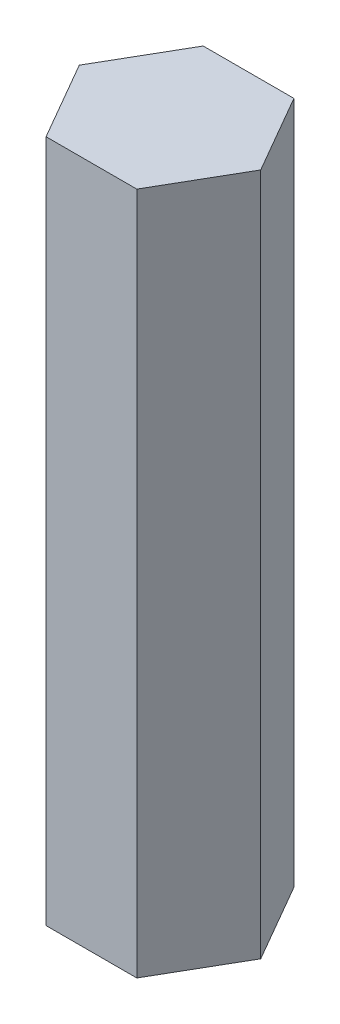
SolidWorks part; units mm, degrees
ref_plane "前视基准面" through (0, 0, 0) normal (0, 0, 1) x (1, 0, 0)
ref_plane "上视基准面" through (0, 0, 0) normal (0, 1, 0) x (1, 0, 0)
ref_plane "右视基准面" through (0, 0, 0) normal (1, 0, 0) x (0, 0, -1)
sketch "草图1" plane through (0, 0, 0) normal (0, 1, 0) x (1, 0, 0)
  line L1 (1.6598, -2.875) -> (3.3198, -0.0001)
  line L2 (3.3198, -0.0001) -> (1.6599, 2.875)
  line L3 (1.6599, 2.875) -> (-1.6598, 2.875)
  line L4 (-1.6598, 2.875) -> (-3.3198, 0.0001)
  line L5 (-3.3198, 0.0001) -> (-1.6599, -2.875)
  line L6 (-1.6599, -2.875) -> (1.6598, -2.875)
  circle A0 centre (0, 0) radius 2.875 construction
  dimension "D1" = 5.75
extrude "凸台-拉伸1" add sketch "草图1" along normal blind 25
